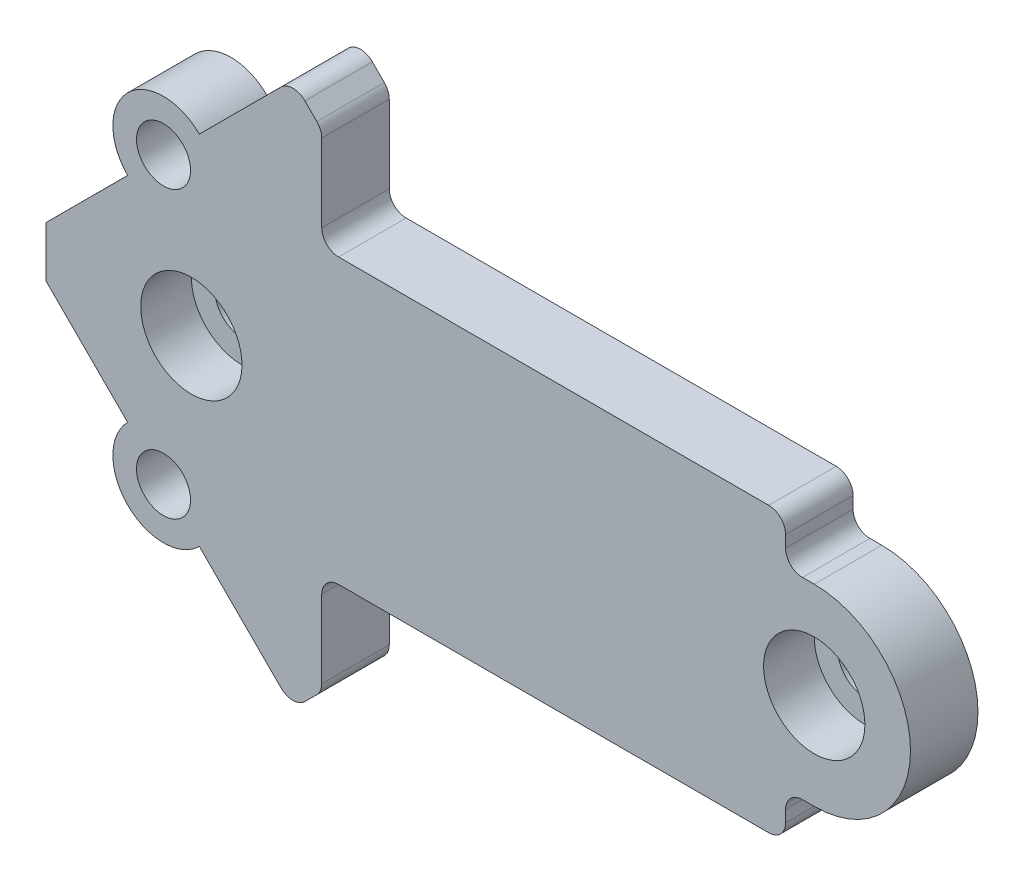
SolidWorks part; units mm, degrees
ref_plane "Ebene vorne" through (0, 0, 0) normal (0, 0, 1) x (1, 0, 0)
ref_plane "Ebene oben" through (0, 0, 0) normal (0, 1, 0) x (1, 0, 0)
ref_plane "Ebene rechts" through (0, 0, 0) normal (1, 0, 0) x (0, 0, -1)
sketch "Skizze1" plane through (0, 0, 0) normal (0, 0, 1) x (1, 0, 0)
  line L0 (0, 0) -> (36.9, 0) construction
  line L1 (0, 3.7) -> (3.7, 3.7) construction
  line L2 (3.7, -6.4) -> (33.2, -6.4) construction
  line L3 (3.7, -6.4) -> (3.7, -3.7) construction
  line L4 (3.7, 6.4) -> (33.2, 6.4) construction
  line L5 (33.2, -6.4) -> (33.2, -3.7) construction
  line L6 (3.7, -6.4) -> (33.2, 6.4) construction
  line L7 (3.7, 6.4) -> (33.2, -6.4) construction
  line L8 (0, -3.7) -> (3.7, -3.7) construction
  line L9 (36.9, 3.7) -> (33.2, 3.7) construction
  line L10 (36.9, -3.7) -> (33.2, -3.7) construction
  line L11 (33.2, 3.7) -> (33.2, 6.4) construction
  line L12 (3.7, 3.7) -> (3.7, 6.4) construction
  line L13 (0, 5.7) -> (1.7, 5.7)
  line L14 (1.7, 5.7) -> (1.7, 8.4)
  line L15 (1.7, 8.4) -> (35.2, 8.4)
  line L16 (35.2, 5.7) -> (35.2, 8.4)
  line L17 (36.9, 5.7) -> (35.2, 5.7)
  line L18 (36.9, -5.7) -> (35.2, -5.7)
  line L19 (35.2, -8.4) -> (35.2, -5.7)
  line L20 (1.7, -8.4) -> (35.2, -8.4)
  line L21 (1.7, -8.4) -> (1.7, -5.7)
  line L22 (0, -5.7) -> (1.7, -5.7)
  arc A0 (0, 3.7) -> (0, -3.7) centre (0, 0) ccw construction
  arc A1 (36.9, -3.7) -> (36.9, 3.7) centre (36.9, 0) ccw construction
  arc A2 (36.9, -5.7) -> (36.9, 5.7) centre (36.9, 0) ccw
  arc A3 (0, 5.7) -> (0, -5.7) centre (0, 0) ccw
  point P5 (18.45, 0)
  dimension "D1" = 7.4
  dimension "D2" = 7.4
  dimension "D3" = 36.9
  dimension "D4" = 12.8
  dimension "D5" = 29.5
  dimension "D6" = 2
extrude "Aufsatz-Linear austragen1" add sketch "Skizze1" along normal blind 13.8
sketch "Skizze5" plane through (0, 0, 13.8) normal (0, 0, 1) x (1, 0, 0)
  line L0 (0, 3.7) -> (3.7, 3.7)
  line L1 (3.7, 3.7) -> (3.7, 6.4)
  line L2 (3.7, 6.4) -> (33.2, 6.4)
  line L3 (33.2, 6.4) -> (33.2, 3.7)
  line L4 (33.2, 3.7) -> (36.9, 3.7)
  line L5 (36.9, -3.7) -> (33.2, -3.7)
  line L6 (33.2, -3.7) -> (33.2, -6.4)
  line L7 (33.2, -6.4) -> (3.7, -6.4)
  line L8 (3.7, -6.4) -> (3.7, -3.7)
  line L9 (3.7, -3.7) -> (0, -3.7)
  arc A0 (0, 3.7) -> (0, -3.7) centre (0, 0) ccw
  arc A1 (36.9, -3.7) -> (36.9, 3.7) centre (36.9, 0) ccw
extrude "Schnitt-Linear austragen4" cut sketch "Skizze5" against normal blind 7.4
sketch "Skizze6" plane through (0, 0, 6.4) normal (0, 0, 1) x (1, 0, 0)
  circle A0 centre (0, 0) radius 3
  circle A1 centre (36.9, 0) radius 3
  dimension "D1" = 6
  dimension "D2" = 6
extrude "Aufsatz-Linear austragen2" add sketch "Skizze6" along normal blind 5.1
sketch "Skizze7" plane through (0, 0, 11.5) normal (0, 0, 1) x (1, 0, 0)
  circle A0 centre (0, 0) radius 1.25
  circle A1 centre (36.9, 0) radius 1.25
  dimension "D1" = 2.5
  dimension "D2" = 2.5
extrude "Schnitt-Linear austragen5" cut sketch "Skizze7" against normal blind 10
sketch "Skizze8" plane through (0, 8.4, 0) normal (0, 1, 0) x (1, 0, 0)
  line L0 (18.45, 0) -> (18.45, -13.8) construction
  line L1 (35.2, 0) -> (1.7, 0) construction
  line L2 (35.2, -13.8) -> (1.7, -13.8) construction
  line L4 (13.05, -13.8) -> (23.85, -13.8)
  line L5 (13.05, -13.8) -> (13.05, -4.8)
  line L6 (13.05, -4.8) -> (23.85, -4.8)
  line L7 (23.85, -13.8) -> (23.85, -4.8)
  point P10 (18.45, -4.8)
  dimension "D1" = 9
  dimension "D2" = 10.8
extrude "Schnitt-Linear austragen6" cut sketch "Skizze8" against normal blind 5
sketch "Skizze9" plane through (0, 0, 13.8) normal (0, 0, 1) x (1, 0, 0)
  line L0 (42.6, 0) -> (-19.4301, 0) construction
  line L1 (-1.65, 8.455) -> (-1.65, -8.455) construction
  line L2 (-8.61, 1.5) -> (-8.61, -1.5)
  line L3 (-8.61, 1.5) -> (-3.7721, 6.3344)
  line L4 (6.7251, 15.4104) -> (7.4319, 14.703)
  line L5 (7.4314, 13.2888) -> (1.7, 7.5615)
  line L6 (6.7251, -15.4104) -> (7.4319, -14.703)
  line L7 (7.4314, -13.2888) -> (1.7, -7.5615)
  line L8 (-8.61, -1.5) -> (-3.7721, -6.3344)
  line L9 (1.7, -5.7) -> (1.7, -7.5615)
  line L10 (1.7, -5.7) -> (1.7, -8.4) construction
  line L11 (1.7, -5.7) -> (-0.3, -5.5629)
  line L12 (0.4721, -10.5756) -> (5.3109, -15.4109)
  line L13 (-0.3, -5.5629) -> (-3.7433, -2.1221)
  line L14 (0.4721, 10.5756) -> (5.3109, 15.4109)
  line L15 (1.7, 7.5615) -> (1.7, 5.7)
  line L16 (1.7, 8.4) -> (1.7, 5.7) construction
  line L17 (1.7, 5.7) -> (-0.3, 5.5629)
  line L18 (-0.3, 5.5629) -> (-3.7433, 2.1221)
  arc A0 (36.9, -5.7) -> (36.9, 5.7) centre (36.9, 0) ccw construction
  circle A1 centre (-1.65, 8.455) radius 1.6
  circle A2 centre (-1.65, -8.455) radius 1.6
  circle A3 centre (0, 0) radius 1.25 construction
  arc A4 (7.4319, 14.703) -> (7.4314, 13.2888) centre (6.7246, 13.9961) cw
  arc A5 (5.3109, 15.4109) -> (6.7251, 15.4104) centre (6.0177, 14.7035) cw
  arc A6 (7.4319, -14.703) -> (7.4314, -13.2888) centre (6.7246, -13.9961) ccw
  arc A7 (5.3109, -15.4109) -> (6.7251, -15.4104) centre (6.0177, -14.7035) ccw
  arc A8 (-3.7433, 2.1221) -> (-3.7433, -2.1221) centre (-1.6227, 0) ccw
  arc A10 (-3.7721, -6.3344) -> (0.4721, -10.5756) centre (-1.65, -8.455) ccw
  arc A11 (0.4721, 10.5756) -> (-3.7721, 6.3344) centre (-1.65, 8.455) ccw
  point P11 (-1.65, 0)
  point P17 (-8.61, 0)
  point P22 (8.1388, 13.9956)
  point P25 (6.0182, 16.1177)
  point P34 (-5.8669, 0)
  dimension "D2" = 3.2
  dimension "D3" = 3.2
  dimension "D4" = 1.65
  dimension "D9" = 1
  dimension "D10" = 3
  dimension "D11" = 3
  dimension "D12" = 6
  dimension "D1" = 16.91
  dimension "D5" = 3
  dimension "D6" = 6.96
  dimension "D7" = 20.68
  dimension "D8" = 3
  dimension "D13" = 2
  dimension "D14" = 2
extrude "Aufsatz-Linear austragen3" add sketch "Skizze9" against normal up to surface (13.8 mm away) contours A1 | A2 | L2 L8 A10 L12 A7 L6 A6 L7 L9 L11 L13 A8 L18 L17 L15 L5 A4 L4 A5 L14 A11 L3
sketch "Skizze10" plane through (0, 0, 13.8) normal (0, 0, 1) x (1, 0, 0)
  line L0 (7.7246, 13.9961) -> (7.7246, 8.4)
  line L2 (13.05, 8.4) -> (2.5391, 8.4) construction
  line L3 (7.7246, 8.4) -> (2.5391, 8.4)
  line L4 (2.5391, 8.4) -> (7.7246, 13.9961)
  line L5 (-8.61, 0) -> (42.6, 0) construction
  line L6 (-8.61, 1.5) -> (-8.61, -1.5) construction
  line L7 (7.7246, -8.4) -> (2.5391, -8.4)
  line L8 (7.7246, -13.9961) -> (7.7246, -8.4)
  line L9 (2.5391, -8.4) -> (7.7246, -13.9961)
  arc A1 (7.4314, 13.2888) -> (7.4319, 14.703) centre (6.7246, 13.9961) ccw construction
  arc A2 (36.9, -5.7) -> (36.9, 5.7) centre (36.9, 0) ccw construction
extrude "Aufsatz-Linear austragen4" add sketch "Skizze10" against normal up to surface (13.8 mm away) contours L0 M34 M33 M32 | L4 M33 M34 | L7 L9 L8
fillet "Verrundung1" radius 1 6 edges at (7.7246, -8.4, 6.9) (35.2, -8.4, 6.9) (35.2, -5.7, 6.9) (35.2, 5.7, 6.9) (35.2, 8.4, 6.9) (7.7246, 8.4, 6.9)
sketch "Skizze14" plane through (0, 0, 13.8) normal (0, 0, 1) x (1, 0, 0)
  line L0 (0, 0) -> (36.9, 0) construction
  line L1 (18.45, -6.4) -> (18.45, 8.4) construction
  line L2 (3.7, -6.4) -> (33.2, -6.4) construction
  line L3 (23.85, 8.4) -> (13.05, 8.4) construction
  line L5 (33.45, -6.5) -> (3.45, -6.5)
  line L6 (33.45, -6.5) -> (33.45, 6.5)
  line L7 (33.45, 6.5) -> (3.45, 6.5)
  line L8 (3.45, -6.5) -> (3.45, 6.5)
  line L9 (33.45, -6.5) -> (3.45, 6.5) construction
  line L10 (33.45, 6.5) -> (3.45, -6.5) construction
  point P10 (18.45, 0)
  dimension "D1" = 30
  dimension "D2" = 13
extrude "Schnitt-Linear austragen8" cut sketch "Skizze14" against normal up to surface (7.4 mm away)
sketch "Skizze15" plane through (0, 0, 13.8) normal (0, 0, 1) x (1, 0, 0)
  line L1 (-100.0932, 69.3227) -> (53.0236, 69.3227)
  line L2 (-100.0932, 69.3227) -> (-100.0932, -21.0847)
  line L3 (-100.0932, -21.0847) -> (53.0236, -21.0847)
  line L4 (53.0236, 69.3227) -> (53.0236, -21.0847)
  line L5 (-100.0932, 69.3227) -> (53.0236, -21.0847) construction
  line L6 (-100.0932, -21.0847) -> (53.0236, 69.3227) construction
  point P0 (-23.5348, 24.119)
extrude "Schnitt-Linear austragen9" cut sketch "Skizze15" against normal blind 9.8
sketch "Skizze16" plane through (0, 0, 4) normal (0, 0, 1) x (1, 0, 0)
  circle A0 centre (0, 0) radius 1.6
  circle A1 centre (36.9, 0) radius 1.6
  dimension "D1" = 3.2
  dimension "D2" = 3.2
extrude "Schnitt-Linear austragen10" cut sketch "Skizze16" against normal blind 9.8
sketch "Skizze17" plane through (0, 0, 4) normal (0, 0, 1) x (1, 0, 0)
  circle A0 centre (0, 0) radius 3
  circle A1 centre (36.9, 0) radius 3
  dimension "D1" = 6
  dimension "D2" = 6
extrude "Schnitt-Linear austragen11" cut sketch "Skizze17" against normal blind 2
sketch "Skizze18" plane through (0, 0, 4) normal (0, 0, 1) x (1, 0, 0)
  circle A0 centre (0, 0) radius 3
  circle A1 centre (36.9, 0) radius 3
  dimension "D1" = 6
  dimension "D2" = 6
extrude "Schnitt-Linear austragen12" cut sketch "Skizze18" against normal blind 3
